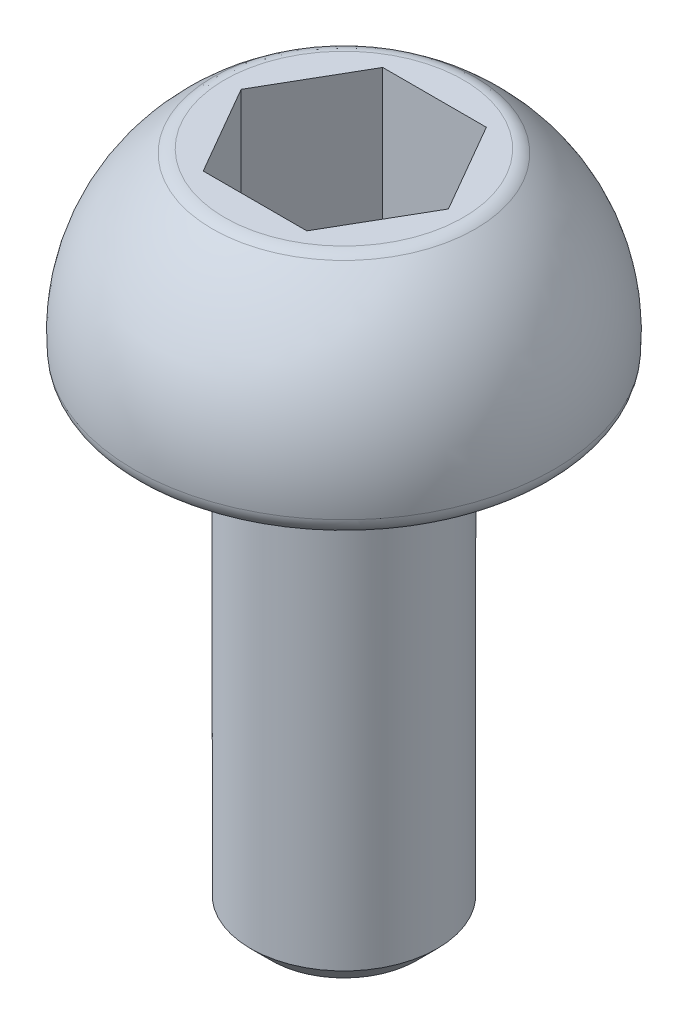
SolidWorks part; units mm, degrees
ref_plane "Plan1" through (0, 0, 0) normal (0, 0, 1) x (1, 0, 0)
ref_plane "Plan2" through (0, 0, 0) normal (0, 1, 0) x (1, 0, 0)
ref_plane "Plan3" through (0, 0, 0) normal (1, 0, 0) x (0, 0, -1)
sketch "Esquisse1" plane through (0, 0, 0) normal (0, 0, 1) x (1, 0, 0)
  line L0 (342.9565, 500.275) -> (342.9565, 468.0959) construction
  line L1 (342.9565, 500.275) -> (342.9565, 468.0959)
  line L170 (338.4565, 468.0959) -> (342.9565, 468.0959)
  line L171 (338.4565, 468.0959) -> (338.4565, 491.002)
  line L174 (338.4565, 491.002) -> (332.9565, 491.002)
  line L176 (336.8868, 500.275) -> (342.9565, 500.275)
  arc A48 (332.9565, 491.002) -> (336.8868, 500.275) centre (341.9618, 492.6546) cw
  point P399 (342.9972, 500.275)
  dimension "D1" = 10
  dimension "D2" = 4.5
revolve "Base-Révolution" add sketch "Esquisse1" angle 360 about L0
chamfer "Chanfrein1" distance 1 angle 45
sketch "Esquisse2" plane through (0, 500.275, 0) normal (0, 1, 0) x (-1, 0, 0)
  line L0 (-345.4972, 4.3301) -> (-340.4972, 4.3301)
  line L1 (-340.4972, 4.3301) -> (-337.9972, 0)
  line L2 (-337.9972, 0) -> (-340.4972, -4.3301)
  line L3 (-340.4972, -4.3301) -> (-345.4972, -4.3301)
  line L5 (-345.4972, 4.3301) -> (-347.9972, 0)
  line L6 (-347.9972, 0) -> (-345.4972, -4.3301)
  point P3 (-347.9972, 0)
  point P4 (-345.4972, 4.3301)
  point P7 (-340.4972, 4.3301)
  point P8 (-337.9972, 0)
  point P9 (-340.4972, -4.3301)
  point P10 (-345.4972, -4.3301)
extrude "Enlèv. mat.-Extru.1" cut sketch "Esquisse2" against normal blind 7
fillet "Congé1" radius 1
fillet "Congé2" radius 1
scale "Echelle6"
scale "Echelle7"
scale "Echelle8"
scale "Echelle9"
scale "Echelle10"
